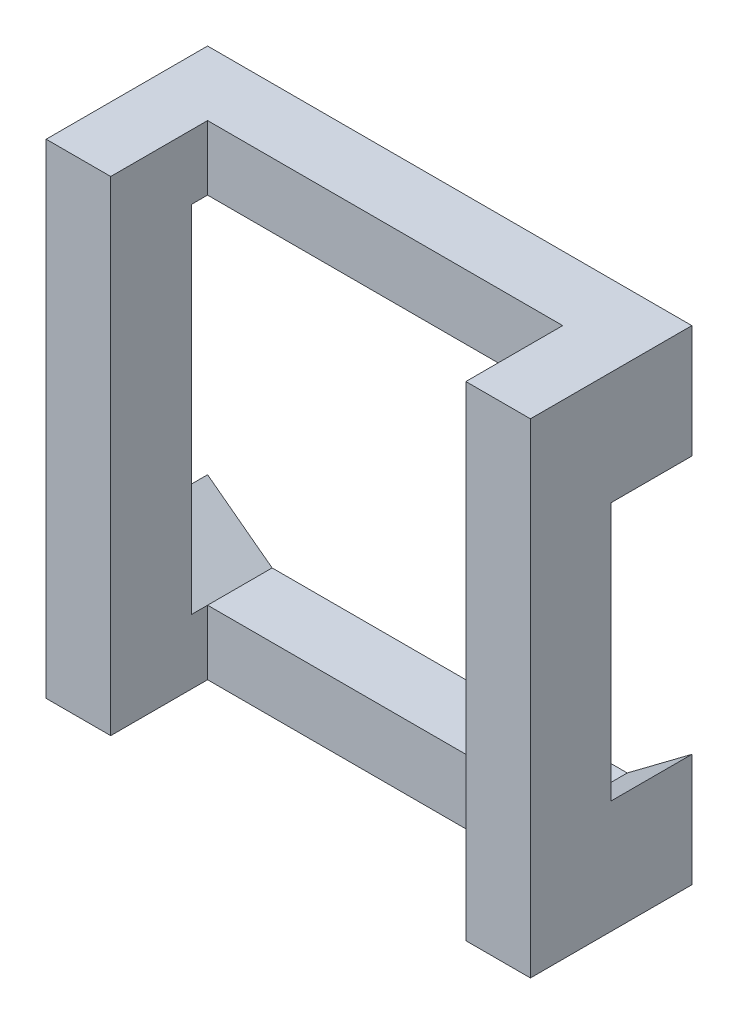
SolidWorks part; units mm, degrees
ref_plane "Front Plane" through (0, 0, 0) normal (0, 0, 1) x (1, 0, 0)
ref_plane "Top Plane" through (0, 0, 0) normal (0, 1, 0) x (1, 0, 0)
ref_plane "Right Plane" through (0, 0, 0) normal (1, 0, 0) x (0, 0, -1)
sketch "Sketch1" plane through (0, 0, 0) normal (0, 0, 1) x (1, 0, 0)
  line L5 (0, 0) -> (6, 0)
  line L6 (0, 0) -> (0, 6)
  line L7 (0, 6) -> (6, 6)
  line L8 (6, 0) -> (6, 6)
  dimension "D1" = 6
extrude "Boss-Extrude1" add sketch "Sketch1" along normal blind 2
sketch "Sketch2" plane through (0, 0, 0) normal (0, 0, -1) x (-1, 0, 0)
  line L0 (-5.2, 5.2) -> (-0.8, 5.2)
  line L1 (-6, 6) -> (0, 6) construction
  line L2 (0, 6) -> (0, 0) construction
  line L3 (-6, 0) -> (-6, 6) construction
  line L4 (-0.8, 5.2) -> (0, 4.6)
  line L5 (-5.2, 5.2) -> (-6, 4.6)
  line L6 (-8.7951, 3) -> (3.6626, 3) construction
  line L7 (0, 0) -> (-6, 0) construction
  line L8 (-0.8, 0.8) -> (0, 1.4)
  line L9 (-5.2, 0.8) -> (-0.8, 0.8)
  line L10 (-5.2, 0.8) -> (-6, 1.4)
  line L11 (-6, 4.6) -> (-6, 1.4)
  line L12 (0, 4.6) -> (0, 1.4)
  dimension "D1" = 0.8
  dimension "D2" = 0.8
  dimension "D3" = 0.8
  dimension "D4" = 1.4
extrude "Cut-Extrude1" cut sketch "Sketch2" against normal blind 1
sketch "Sketch3" plane through (0, 0, 1) normal (0, 0, -1) x (-1, 0, 0)
  line L0 (-0.8, 5.2) -> (-5.2, 5.2) construction
  line L1 (-0.8, 0.8) -> (-5.2, 0.8)
  line L2 (-0.8, 0.8) -> (-0.8, 5.2)
  line L3 (-0.8, 5.2) -> (-5.2, 5.2)
  line L4 (-5.2, 0.8) -> (-5.2, 5.2)
  line L5 (-5.2, 0.8) -> (-0.8, 0.8) construction
extrude "Cut-Extrude2" cut sketch "Sketch3" against normal blind 1
sketch "Sketch4" plane through (0, 0, 0) normal (0, -1, 0) x (1, 0, 0)
  line L0 (0, 2) -> (6, 2) construction
  line L1 (5.2, 2) -> (0.8, 2)
  line L2 (5.2, 2) -> (5.2, 0.8)
  line L3 (5.2, 0.8) -> (0.8, 0.8)
  line L4 (0.8, 2) -> (0.8, 0.8)
  line L5 (6, 2) -> (6, 0) construction
  line L6 (0, 2) -> (0, 0) construction
  line L7 (0, 0) -> (6, 0) construction
  dimension "D1" = 0.8
  dimension "D2" = 0.8
  dimension "D3" = 0.8
extrude "Cut-Extrude3" cut sketch "Sketch4" against normal through all
